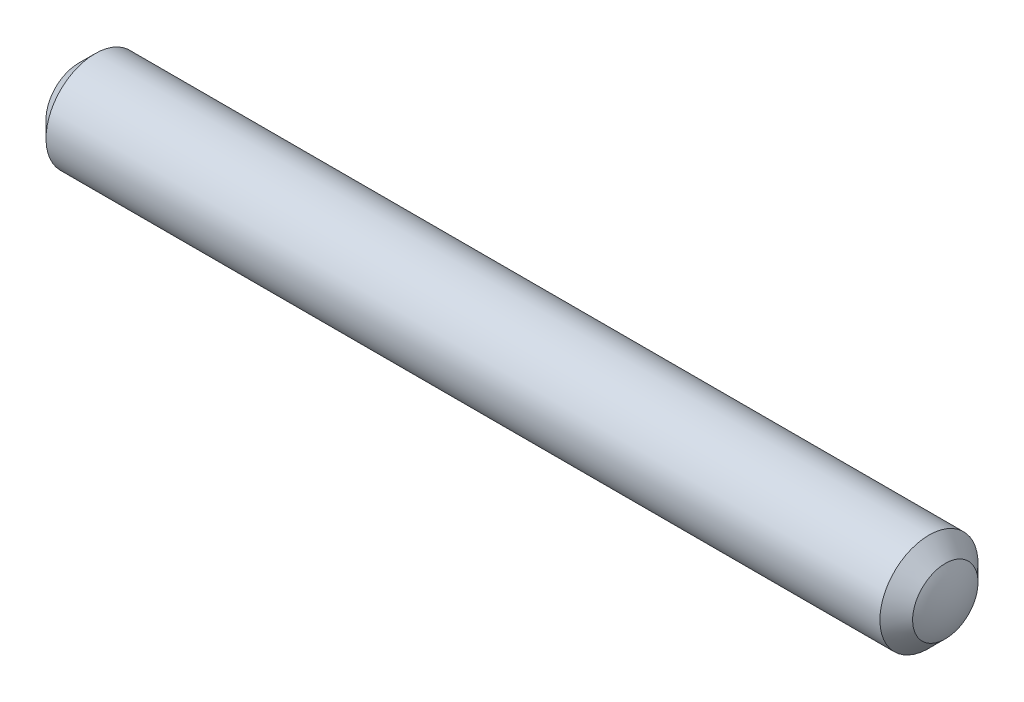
SolidWorks part; units mm, degrees
ref_plane "Plan1" through (0, 0, 0) normal (0, 0, 1) x (1, 0, 0)
ref_plane "Plan2" through (0, 0, 0) normal (0, 1, 0) x (1, 0, 0)
ref_plane "Plan3" through (0, 0, 0) normal (1, 0, 0) x (0, 0, -1)
sketch "Esquisse1" plane through (0, 0, 0) normal (0, 0, 1) x (1, 0, 0)
  line L0 (0, 0) -> (-55, 0) construction
  line L1 (0, 0) -> (0, 2)
  line L2 (0, 2) -> (-1, 3)
  line L3 (-1, 3) -> (-52, 3)
  line L4 (-52, 3) -> (-53, 2)
  line L5 (-53, 2) -> (-53, 0)
  line L6 (0, 0) -> (-53, 0)
  dimension "D1" = 45
  dimension "D2" = 1
  dimension "D3" = 45
  dimension "D4" = 1
  dimension "D5" = 53
  dimension "D6" = 6
revolve "Base-Révolution" add sketch "Esquisse1" angle 360 about L0
dome "Dôme1" faces to dome 1 distance 0.5 parameters "D1"=0.5
sketch "Esquisse2" plane through (0, 0, 0) normal (0, 0, 1) x (1, 0, 0)
  line L0 (-53, 0) -> (0.5, 0) construction
  line L1 (-53, 2) -> (-53, -2) construction
  arc A0 (0, -2) -> (0, 2) centre (-3.75, 0) ccw construction
